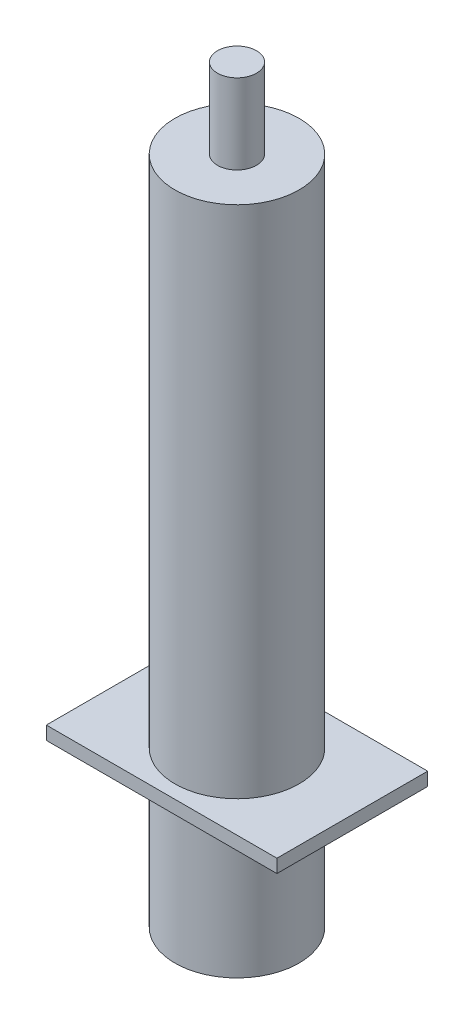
SolidWorks part; units mm, degrees
ref_plane "前视基准面" through (0, 0, 0) normal (0, 0, 1) x (1, 0, 0)
ref_plane "上视基准面" through (0, 0, 0) normal (0, 1, 0) x (1, 0, 0)
ref_plane "右视基准面" through (0, 0, 0) normal (1, 0, 0) x (0, 0, -1)
other "Configuration Table"
sketch "草图1" plane through (0, 0, 0) normal (0, 1, 0) x (1, 0, 0)
  circle A0 centre (0, 0) radius 7
extrude "凸台-拉伸1" add sketch "草图1" along normal blind 58
sketch "草图2" plane through (0, 58, 0) normal (0, 1, 0) x (1, 0, 0)
  circle A0 centre (0, 0) radius 2.2
extrude "凸台-拉伸2" add sketch "草图2" along normal blind 9
sketch "草图3" plane through (0, 0, 0) normal (0, -1, 0) x (1, 0, 0)
  line L1 (-13, -8.5) -> (13, -8.5)
  line L2 (-13, -8.5) -> (-13, 8.5)
  line L3 (-13, 8.5) -> (13, 8.5)
  line L4 (13, -8.5) -> (13, 8.5)
  line L5 (-13, -8.5) -> (13, 8.5) construction
  line L6 (-13, 8.5) -> (13, -8.5) construction
  circle A0 centre (0, 0) radius 7
  point P0 (0, 0)
  dimension "D1" = 26
  dimension "D2" = 17
extrude "凸台-拉伸3" add sketch "草图3" along normal blind 1.5 contours L2 L1 L4 L3
sketch "草图4" plane through (0, -1.5, 0) normal (0, -1, 0) x (1, 0, 0)
  circle A0 centre (0, 0) radius 7
extrude "凸台-拉伸4" add sketch "草图4" along normal blind 16
